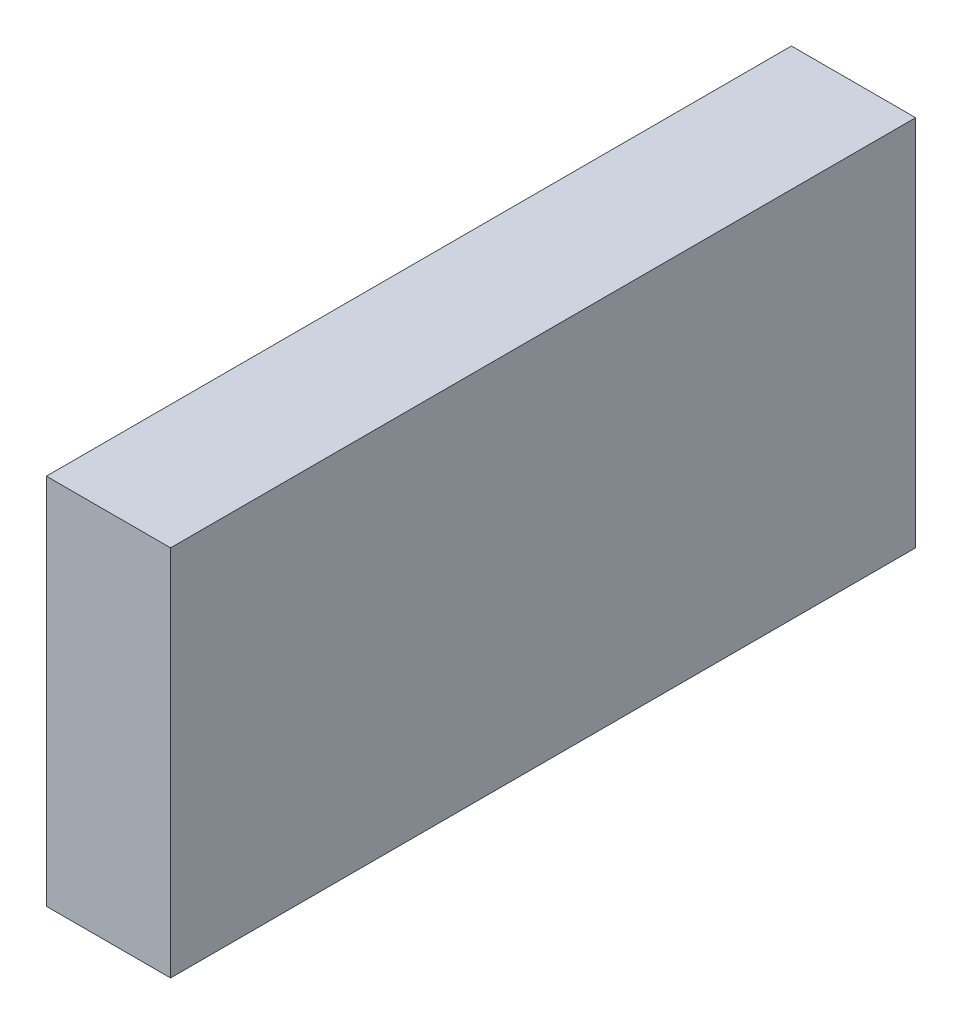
SolidWorks part; units mm, degrees
ref_plane "Front Plane" through (0, 0, 0) normal (0, 0, 1) x (1, 0, 0)
ref_plane "Top Plane" through (0, 0, 0) normal (0, 1, 0) x (1, 0, 0)
ref_plane "Right Plane" through (0, 0, 0) normal (1, 0, 0) x (0, 0, -1)
sketch "Sketch1" plane through (0, 0, 0) normal (1, 0, 0) x (0, 0, -1)
  line L0 (0, 0) -> (76.2, 0)
  line L1 (0, 0) -> (0, 38.1)
  line L2 (76.2, 0) -> (76.2, 38.1)
  line L3 (0, 38.1) -> (76.2, 38.1)
  dimension "D1" = 76.2
  dimension "D2" = 38.1
extrude "Boss-Extrude1" add sketch "Sketch1" along normal blind 12.7
